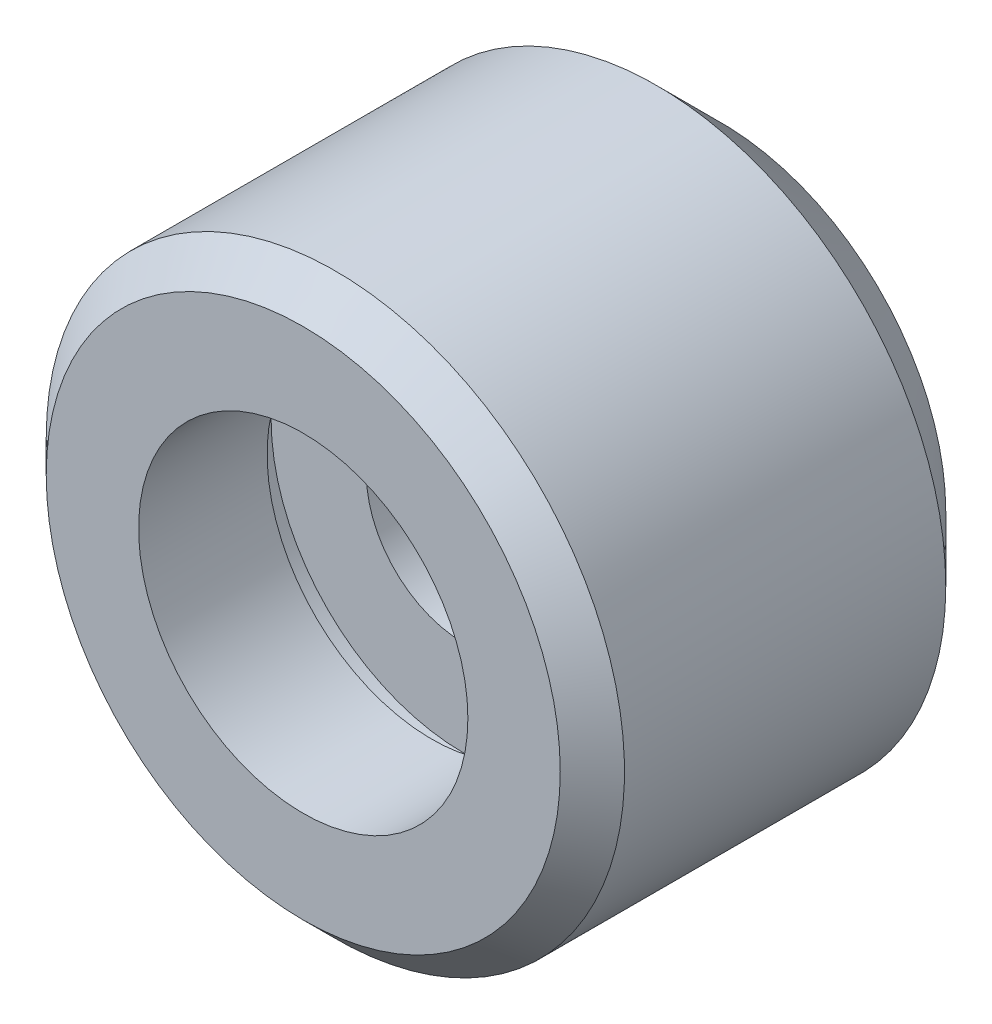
SolidWorks part; units mm, degrees
ref_plane "Face" through (0, 0, 0) normal (0, 0, 1) x (1, 0, 0)
ref_plane "Dessus" through (0, 0, 0) normal (0, 1, 0) x (1, 0, 0)
ref_plane "Droite" through (0, 0, 0) normal (1, 0, 0) x (0, 0, -1)
sketch "Esquisse1" plane through (0, 0, 0) normal (0, 0, 1) x (1, 0, 0)
  circle A0 centre (0, 0) radius 9
  dimension "D1" = 18
extrude "Base-Extrusion" add sketch "Esquisse1" along normal blind 13
chamfer "Chanfrein1" distance 1 angle 45 1 edges at (9, 0, 13)
chamfer "Chanfrein2" distance 2 angle 45 1 edges at (9, 0, 0)
sketch "Esquisse2" plane through (0, 0, 13) normal (0, 0, 1) x (1, 0, 0)
  circle A0 centre (0, 0) radius 5.125
  dimension "D1" = 10.25
extrude "Enlèv. mat.-Extru.1" cut sketch "Esquisse2" against normal blind 4
sketch "Esquisse3" plane through (0, 0, 9) normal (0, 0, 1) x (1, 0, 0)
  circle A0 centre (0, 0) radius 6
  dimension "D1" = 12
extrude "Enlèv. mat.-Extru.2" cut sketch "Esquisse3" against normal blind 1
sketch "Esquisse4" plane through (0, 0, 0) normal (0, 0, -1) x (-1, 0, 0)
  circle A0 centre (0, 0) radius 3.035
  dimension "D1" = 6.07
extrude "Enlèv. mat.-Extru.3" cut sketch "Esquisse4" against normal through all
thread "Filetage1" pitch 1.75 start angle 0, offset 5, length 0, pitch 1.75, diameter 10.25
ref_plane "Plan1" through (-5.125, 0, 18) normal (0, -1, 0) x (-1, 0, 0)
sketch "Profil de filetage1" plane through (-5.125, 0, 18) normal (0, -1, 0) x (-1, 0, 0)
  line L0 (0, 0) -> (0, 1.75) construction
  line L1 (0, 0) -> (0.9472, 0.5469)
  line L2 (0.9472, 0.5469) -> (0.9472, 0.7656)
  line L3 (0.9472, 0.7656) -> (0, 1.3125)
  line L4 (0.9472, 0.6562) -> (0, 0.6562) construction
  line L11 (0, 0) -> (0, 1.3125)
  point P2 (0, 0)
  dimension "Pitch" = 1.75
  dimension "Profile_Angle" = 60
  dimension "Profile_Land" = 0.2188
  dimension "Profile_Height" = 0.9472
